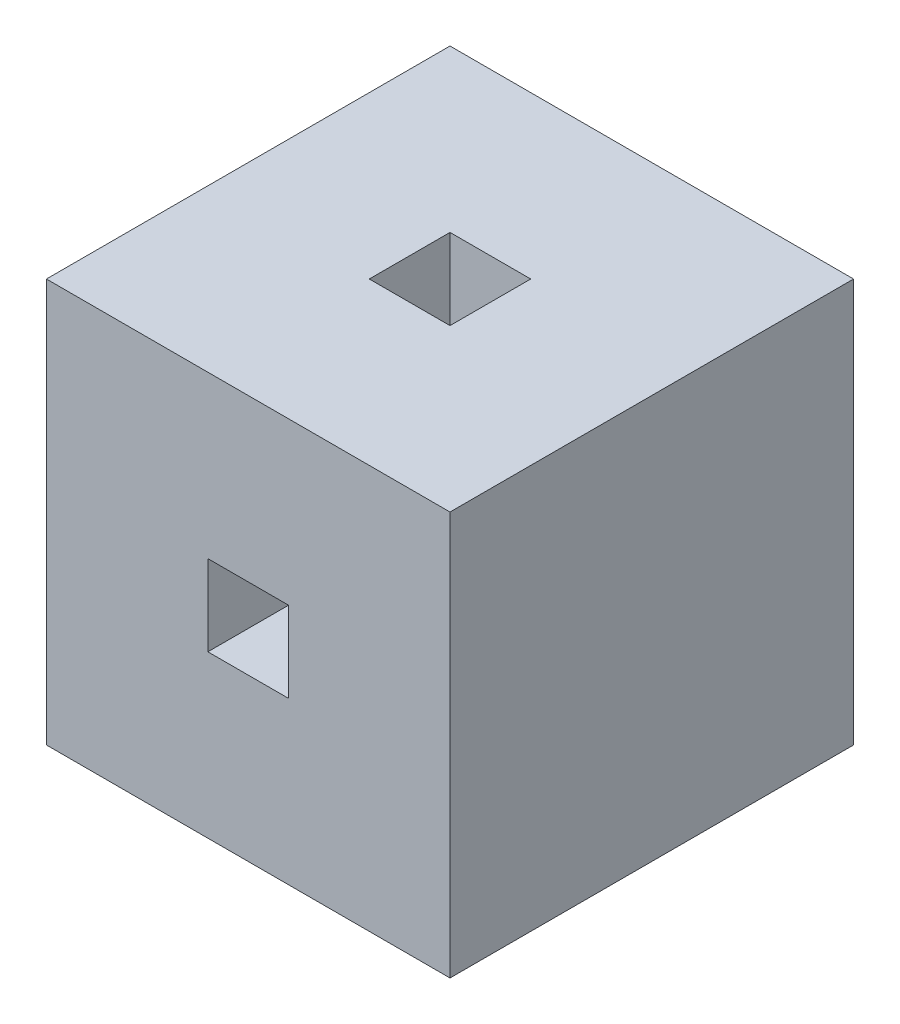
SolidWorks part; units mm, degrees
ref_plane "Ebene vorne" through (0, 0, 0) normal (0, 0, 1) x (1, 0, 0)
ref_plane "Ebene oben" through (0, 0, 0) normal (0, 1, 0) x (1, 0, 0)
ref_plane "Ebene rechts" through (0, 0, 0) normal (1, 0, 0) x (0, 0, -1)
sketch "Skizze1" plane through (0, 0, 0) normal (0, 0, 1) x (1, 0, 0)
  line L1 (-25, -25) -> (25, -25)
  line L2 (-25, -25) -> (-25, 25)
  line L3 (-25, 25) -> (25, 25)
  line L4 (25, -25) -> (25, 25)
  line L5 (-25, -25) -> (25, 25) construction
  line L6 (-25, 25) -> (25, -25) construction
  line L7 (-5, -5) -> (5, -5)
  line L8 (-5, -5) -> (-5, 5)
  line L9 (-5, 5) -> (5, 5)
  line L10 (5, -5) -> (5, 5)
  line L11 (-5, -5) -> (5, 5) construction
  line L12 (-5, 5) -> (5, -5) construction
  point P0 (0, 0)
  point P6 (0, 0)
  dimension "D1" = 50
  dimension "D2" = 50
  dimension "D3" = 10
  dimension "D4" = 10
extrude "Linear austragen1" add sketch "Skizze1" against normal blind 50
sketch "Skizze2" plane through (0, 25, 0) normal (0, 1, 0) x (1, 0, 0)
  line L0 (-25, 25) -> (25, 25) construction
  line L1 (-25, 50) -> (-25, 0) construction
  line L2 (25, 50) -> (25, 0) construction
  line L4 (-5, 20) -> (5, 20)
  line L5 (-5, 20) -> (-5, 30)
  line L6 (-5, 30) -> (5, 30)
  line L7 (5, 20) -> (5, 30)
  line L8 (-5, 20) -> (5, 30) construction
  line L9 (-5, 30) -> (5, 20) construction
  point P6 (0, 25)
  dimension "D1" = 10
  dimension "D2" = 10
extrude "Linear austragen2" cut sketch "Skizze2" against normal through all
